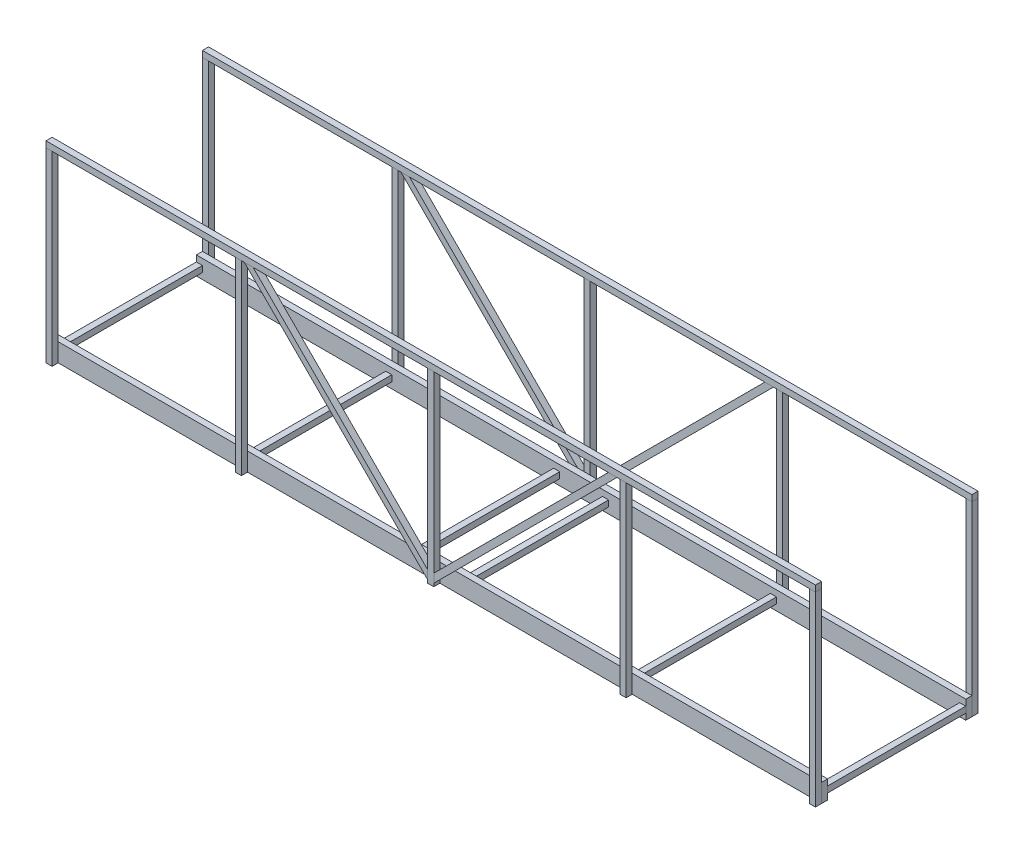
SolidWorks part; units mm, degrees
ref_plane "Front Plane" through (0, 0, 0) normal (0, 0, 1) x (1, 0, 0)
ref_plane "Top Plane" through (0, 0, 0) normal (0, 1, 0) x (1, 0, 0)
ref_plane "Right Plane" through (0, 0, 0) normal (1, 0, 0) x (0, 0, -1)
sketch "Sketch1" plane through (0, 0, 0) normal (0, 1, 0) x (1, 0, 0)
  line L0 (0, 37.5) -> (0, -37.5) construction
  line L1 (-200, -37.5) -> (200, -37.5)
  line L2 (-200, -37.5) -> (-200, 37.5)
  line L3 (-200, 37.5) -> (200, 37.5)
  line L4 (200, -37.5) -> (200, 37.5)
  line L5 (-200, -37.5) -> (200, 37.5) construction
  line L6 (-200, 37.5) -> (200, -37.5) construction
  line L7 (-100, 37.5) -> (-100, -37.5)
  line L8 (-12.7, -37.5) -> (-12.7, 37.5)
  line L9 (12.7, 37.5) -> (12.7, -37.5)
  line L10 (100, 37.5) -> (100, -37.5)
  point P0 (0, 0)
  dimension "D1" = 400
  dimension "D2" = 75
  dimension "D3" = 25.4
  dimension "D4" = 100
  dimension "D5" = 100
other "Structural Member1"
ref_plane "Plane1" through (-200, 0, 37.5) normal (1, 0, 0) x (0, 0, -1)
sketch "Sketch12" plane through (-200, 0, 37.5) normal (1, 0, 0) x (0, 0, -1)
  line L1 (-1.5875, -4.7625) -> (1.5875, -4.7625)
  line L2 (-1.5875, -4.7625) -> (-1.5875, 4.7625)
  line L3 (-1.5875, 4.7625) -> (1.5875, 4.7625)
  line L4 (1.5875, -4.7625) -> (1.5875, 4.7625)
  line L5 (-1.5875, -4.7625) -> (1.5875, 4.7625) construction
  line L6 (-1.5875, 4.7625) -> (1.5875, -4.7625) construction
  point P0 (0, 0)
  point P5 (0, 4.7625)
  point P6 (1.5875, 0)
  point P7 (0, -4.7625)
  point P8 (-1.5875, 0)
  point P9 (0, 0)
  dimension "D1" = 3.175
  dimension "D2" = 9.525
other "Structural Member2"
ref_plane "Plane2" through (200, 0, 37.5) normal (0, 0, -1) x (-1, 0, 0)
sketch "Sketch14" plane through (198.4125, 0, 37.5) normal (0, 0, -1) x (-1, 0, 0)
  line L1 (-1.5875, -1.5875) -> (1.5875, -1.5875)
  line L2 (-1.5875, -1.5875) -> (-1.5875, 1.5875)
  line L3 (-1.5875, 1.5875) -> (1.5875, 1.5875)
  line L4 (1.5875, -1.5875) -> (1.5875, 1.5875)
  line L5 (-1.5875, -1.5875) -> (1.5875, 1.5875) construction
  line L6 (-1.5875, 1.5875) -> (1.5875, -1.5875) construction
  point P0 (0, 0)
  point P5 (-1.5875, 0)
  point P6 (0, 1.5875)
  point P7 (1.5875, 0)
  point P8 (0, -1.5875)
  point P9 (0, 0)
  dimension "D1" = 3.175
other "Structural Member3"
ref_plane "Plane3" through (-200, 0, 37.5) normal (0, 0, -1) x (-1, 0, 0)
sketch "Sketch15" plane through (-198.4125, 0, 37.5) normal (0, 0, -1) x (-1, 0, 0)
  line L1 (-1.5875, -1.5875) -> (1.5875, -1.5875)
  line L2 (-1.5875, -1.5875) -> (-1.5875, 1.5875)
  line L3 (-1.5875, 1.5875) -> (1.5875, 1.5875)
  line L4 (1.5875, -1.5875) -> (1.5875, 1.5875)
  line L5 (-1.5875, -1.5875) -> (1.5875, 1.5875) construction
  line L6 (-1.5875, 1.5875) -> (1.5875, -1.5875) construction
  point P0 (0, 0)
  point P5 (-1.5875, 0)
  point P6 (0, 1.5875)
  point P7 (1.5875, 0)
  point P8 (0, -1.5875)
  point P9 (0, 0)
  dimension "D1" = 3.175
other "Structural Member4"
ref_plane "Plane4" through (-100, 0, -37.5) normal (0, 0, 1) x (1, 0, 0)
sketch "Sketch16" plane through (-100, 0, -37.5) normal (0, 0, 1) x (1, 0, 0)
  line L1 (-1.5875, -1.5875) -> (1.5875, -1.5875)
  line L2 (-1.5875, -1.5875) -> (-1.5875, 1.5875)
  line L3 (-1.5875, 1.5875) -> (1.5875, 1.5875)
  line L4 (1.5875, -1.5875) -> (1.5875, 1.5875)
  line L5 (-1.5875, -1.5875) -> (1.5875, 1.5875) construction
  line L6 (-1.5875, 1.5875) -> (1.5875, -1.5875) construction
  point P0 (0, 0)
  point P5 (-1.5875, 0)
  point P6 (0, 1.5875)
  point P7 (1.5875, 0)
  point P8 (0, -1.5875)
  point P9 (0, 0)
  dimension "D1" = 3.175
other "Trim/Extend1"
sketch "Sketch18" plane through (0, 0, 39.0875) normal (0, 0, 1) x (1, 0, 0)
  line L0 (-200, -4.7625) -> (-200, 95.2375)
  line L1 (-200, 95.2375) -> (200, 95.2375)
  line L2 (200, -4.7625) -> (200, 95.2375)
  line L3 (0, -4.7625) -> (0, 95.2375)
  line L4 (200, -4.7625) -> (-200, -4.7625) construction
  line L5 (-100, 95.2375) -> (-100, -4.7625)
  line L6 (100, 95.2375) -> (100, -4.7625)
  dimension "D1" = 100
  dimension "D2" = 100
  dimension "D3" = 100
other "Structural Member5"
ref_plane "Plane5" through (-200, -4.7625, 39.0875) normal (0, 1, 0) x (-1, 0, 0)
sketch "Sketch17" plane through (-198.4125, -4.7625, 40.675) normal (0, 1, 0) x (-1, 0, 0)
  line L1 (-1.5875, -1.5875) -> (1.5875, -1.5875)
  line L2 (-1.5875, -1.5875) -> (-1.5875, 1.5875)
  line L3 (-1.5875, 1.5875) -> (1.5875, 1.5875)
  line L4 (1.5875, -1.5875) -> (1.5875, 1.5875)
  line L5 (-1.5875, -1.5875) -> (1.5875, 1.5875) construction
  line L6 (-1.5875, 1.5875) -> (1.5875, -1.5875) construction
  point P0 (0, 0)
  point P5 (-1.5875, 0)
  point P6 (0, 1.5875)
  point P7 (1.5875, 0)
  point P8 (0, -1.5875)
  point P9 (0, 0)
  dimension "D1" = 3.175
other "Structural Member6"
ref_plane "Plane6" through (200, -4.7625, 39.0875) normal (0, 1, 0) x (-1, 0, 0)
sketch "Sketch19" plane through (198.4125, -4.7625, 40.675) normal (0, 1, 0) x (-1, 0, 0)
  line L1 (-1.5875, -1.5875) -> (1.5875, -1.5875)
  line L2 (-1.5875, -1.5875) -> (-1.5875, 1.5875)
  line L3 (-1.5875, 1.5875) -> (1.5875, 1.5875)
  line L4 (1.5875, -1.5875) -> (1.5875, 1.5875)
  line L5 (-1.5875, -1.5875) -> (1.5875, 1.5875) construction
  line L6 (-1.5875, 1.5875) -> (1.5875, -1.5875) construction
  point P0 (0, 0)
  point P5 (-1.5875, 0)
  point P6 (0, 1.5875)
  point P7 (1.5875, 0)
  point P8 (0, -1.5875)
  point P9 (0, 0)
  dimension "D1" = 3.175
other "Structural Member7"
ref_plane "Plane7" through (100, 95.2375, 39.0875) normal (0, -1, 0) x (1, 0, 0)
sketch "Sketch110" plane through (100, 95.2375, 40.675) normal (0, -1, 0) x (1, 0, 0)
  line L1 (-1.5875, -1.5875) -> (1.5875, -1.5875)
  line L2 (-1.5875, -1.5875) -> (-1.5875, 1.5875)
  line L3 (-1.5875, 1.5875) -> (1.5875, 1.5875)
  line L4 (1.5875, -1.5875) -> (1.5875, 1.5875)
  line L5 (-1.5875, -1.5875) -> (1.5875, 1.5875) construction
  line L6 (-1.5875, 1.5875) -> (1.5875, -1.5875) construction
  point P0 (0, 0)
  point P5 (-1.5875, 0)
  point P6 (0, 1.5875)
  point P7 (1.5875, 0)
  point P8 (0, -1.5875)
  point P9 (0, 0)
  dimension "D1" = 3.175
other "Structural Member8"
ref_plane "Plane8" through (-200, 95.2375, 39.0875) normal (1, 0, 0) x (0, 1, 0)
sketch "Sketch111" plane through (-200, 93.65, 40.675) normal (1, 0, 0) x (0, 1, 0)
  line L1 (-1.5875, -1.5875) -> (1.5875, -1.5875)
  line L2 (-1.5875, -1.5875) -> (-1.5875, 1.5875)
  line L3 (-1.5875, 1.5875) -> (1.5875, 1.5875)
  line L4 (1.5875, -1.5875) -> (1.5875, 1.5875)
  line L5 (-1.5875, -1.5875) -> (1.5875, 1.5875) construction
  line L6 (-1.5875, 1.5875) -> (1.5875, -1.5875) construction
  point P0 (0, 0)
  point P5 (-1.5875, 0)
  point P6 (0, 1.5875)
  point P7 (1.5875, 0)
  point P8 (0, -1.5875)
  point P9 (0, 0)
  dimension "D1" = 3.175
other "Trim/Extend2"
sketch "Sketch124" plane through (0, 0, -39.0875) normal (0, 0, -1) x (-1, 0, 0)
  line L0 (-200, -4.7625) -> (-200, 95.2375)
  line L1 (200, -4.7625) -> (200, 95.2375)
  line L2 (0, -4.7625) -> (0, 95.2375)
  line L3 (-200, -4.7625) -> (200, -4.7625) construction
  line L4 (-100, -4.7625) -> (-100, 95.2375)
  line L5 (100, -4.7625) -> (100, 95.2375)
  line L6 (200, 95.2375) -> (-200, 95.2375)
  line L7 (200, 95.2375) -> (-200, 95.2375) construction
  line L8 (-100, 95.2375) -> (-100, -4.7625) construction
  line L9 (100, 95.2375) -> (100, -4.7625) construction
other "Structural Member15"
ref_plane "Plane16" through (200, -4.7625, -39.0875) normal (0, 1, 0) x (1, 0, 0)
sketch "Sketch125" plane through (198.4125, -4.7625, -40.675) normal (0, 1, 0) x (1, 0, 0)
  line L1 (-1.5875, -1.5875) -> (1.5875, -1.5875)
  line L2 (-1.5875, -1.5875) -> (-1.5875, 1.5875)
  line L3 (-1.5875, 1.5875) -> (1.5875, 1.5875)
  line L4 (1.5875, -1.5875) -> (1.5875, 1.5875)
  line L5 (-1.5875, -1.5875) -> (1.5875, 1.5875) construction
  line L6 (-1.5875, 1.5875) -> (1.5875, -1.5875) construction
  point P0 (0, 0)
  point P5 (-1.5875, 0)
  point P6 (0, 1.5875)
  point P7 (1.5875, 0)
  point P8 (0, -1.5875)
  point P9 (0, 0)
  dimension "D1" = 3.175
other "Structural Member16"
ref_plane "Plane17" through (-200, -4.7625, -39.0875) normal (0, 1, 0) x (1, 0, 0)
sketch "Sketch126" plane through (-198.4125, -4.7625, -40.675) normal (0, 1, 0) x (1, 0, 0)
  line L1 (-1.5875, -1.5875) -> (1.5875, -1.5875)
  line L2 (-1.5875, -1.5875) -> (-1.5875, 1.5875)
  line L3 (-1.5875, 1.5875) -> (1.5875, 1.5875)
  line L4 (1.5875, -1.5875) -> (1.5875, 1.5875)
  line L5 (-1.5875, -1.5875) -> (1.5875, 1.5875) construction
  line L6 (-1.5875, 1.5875) -> (1.5875, -1.5875) construction
  point P0 (0, 0)
  point P5 (-1.5875, 0)
  point P6 (0, 1.5875)
  point P7 (1.5875, 0)
  point P8 (0, -1.5875)
  point P9 (0, 0)
  dimension "D1" = 3.175
other "Structural Member17"
ref_plane "Plane18" through (100, -4.7625, -39.0875) normal (0, 1, 0) x (1, 0, 0)
sketch "Sketch127" plane through (100, -4.7625, -40.675) normal (0, 1, 0) x (1, 0, 0)
  line L1 (-1.5875, -1.5875) -> (1.5875, -1.5875)
  line L2 (-1.5875, -1.5875) -> (-1.5875, 1.5875)
  line L3 (-1.5875, 1.5875) -> (1.5875, 1.5875)
  line L4 (1.5875, -1.5875) -> (1.5875, 1.5875)
  line L5 (-1.5875, -1.5875) -> (1.5875, 1.5875) construction
  line L6 (-1.5875, 1.5875) -> (1.5875, -1.5875) construction
  point P0 (0, 0)
  point P5 (-1.5875, 0)
  point P6 (0, 1.5875)
  point P7 (1.5875, 0)
  point P8 (0, -1.5875)
  point P9 (0, 0)
  dimension "D1" = 3.175
other "Structural Member18"
ref_plane "Plane19" through (-200, 95.2375, -39.0875) normal (1, 0, 0) x (0, -1, 0)
sketch "Sketch128" plane through (-200, 93.65, -40.675) normal (1, 0, 0) x (0, -1, 0)
  line L1 (-1.5875, -1.5875) -> (1.5875, -1.5875)
  line L2 (-1.5875, -1.5875) -> (-1.5875, 1.5875)
  line L3 (-1.5875, 1.5875) -> (1.5875, 1.5875)
  line L4 (1.5875, -1.5875) -> (1.5875, 1.5875)
  line L5 (-1.5875, -1.5875) -> (1.5875, 1.5875) construction
  line L6 (-1.5875, 1.5875) -> (1.5875, -1.5875) construction
  point P0 (0, 0)
  point P5 (-1.5875, 0)
  point P6 (0, 1.5875)
  point P7 (1.5875, 0)
  point P8 (0, -1.5875)
  point P9 (0, 0)
  dimension "D1" = 3.175
other "Trim/Extend3"
sketch "Sketch112" plane through (0, 0, 39.0875) normal (0, 0, 1) x (1, 0, 0)
  line L0 (0, -4.7625) -> (100, 95.2375)
  line L1 (200, -4.7625) -> (-200, -4.7625) construction
  line L3 (-100, 95.2375) -> (0, -4.7625)
other "Structural Member9"
ref_plane "Plane9" through (0, -4.7625, 39.0875) normal (0.7071, 0.7071, 0) x (-0.7071, 0.7071, 0)
sketch "Sketch113" plane through (-1.1225, -3.64, 40.675) normal (0.7071, 0.7071, 0) x (-0.7071, 0.7071, 0)
  line L1 (-1.5875, -1.5875) -> (1.5875, -1.5875)
  line L2 (-1.5875, -1.5875) -> (-1.5875, 1.5875)
  line L3 (-1.5875, 1.5875) -> (1.5875, 1.5875)
  line L4 (1.5875, -1.5875) -> (1.5875, 1.5875)
  line L5 (-1.5875, -1.5875) -> (1.5875, 1.5875) construction
  line L6 (-1.5875, 1.5875) -> (1.5875, -1.5875) construction
  point P0 (0, 0)
  point P5 (-1.5875, 0)
  point P6 (0, 1.5875)
  point P7 (1.5875, 0)
  point P8 (0, -1.5875)
  point P9 (0, 0)
  dimension "D1" = 3.175
other "Trim/Extend6"
sketch "Sketch129" plane through (0, 0, -39.0875) normal (0, 0, -1) x (-1, 0, 0)
  line L0 (0, -4.7625) -> (100, 95.2375)
  line L1 (0, -4.7625) -> (-100, 95.2375)
other "Structural Member19"
ref_plane "Plane20" through (0, -4.7625, -39.0875) normal (0.7071, 0.7071, 0) x (0.7071, -0.7071, 0)
sketch "Sketch130" plane through (-1.1225, -3.64, -40.675) normal (0.7071, 0.7071, 0) x (0.7071, -0.7071, 0)
  line L1 (-1.5875, -1.5875) -> (1.5875, -1.5875)
  line L2 (-1.5875, -1.5875) -> (-1.5875, 1.5875)
  line L3 (-1.5875, 1.5875) -> (1.5875, 1.5875)
  line L4 (1.5875, -1.5875) -> (1.5875, 1.5875)
  line L5 (-1.5875, -1.5875) -> (1.5875, 1.5875) construction
  line L6 (-1.5875, 1.5875) -> (1.5875, -1.5875) construction
  point P0 (0, 0)
  point P5 (-1.5875, 0)
  point P6 (0, 1.5875)
  point P7 (1.5875, 0)
  point P8 (0, -1.5875)
  point P9 (0, 0)
  dimension "D1" = 3.175
other "Trim/Extend17"
equation "\"D2@Sketch12\" = \"D1@Sketch12\" * 3"
